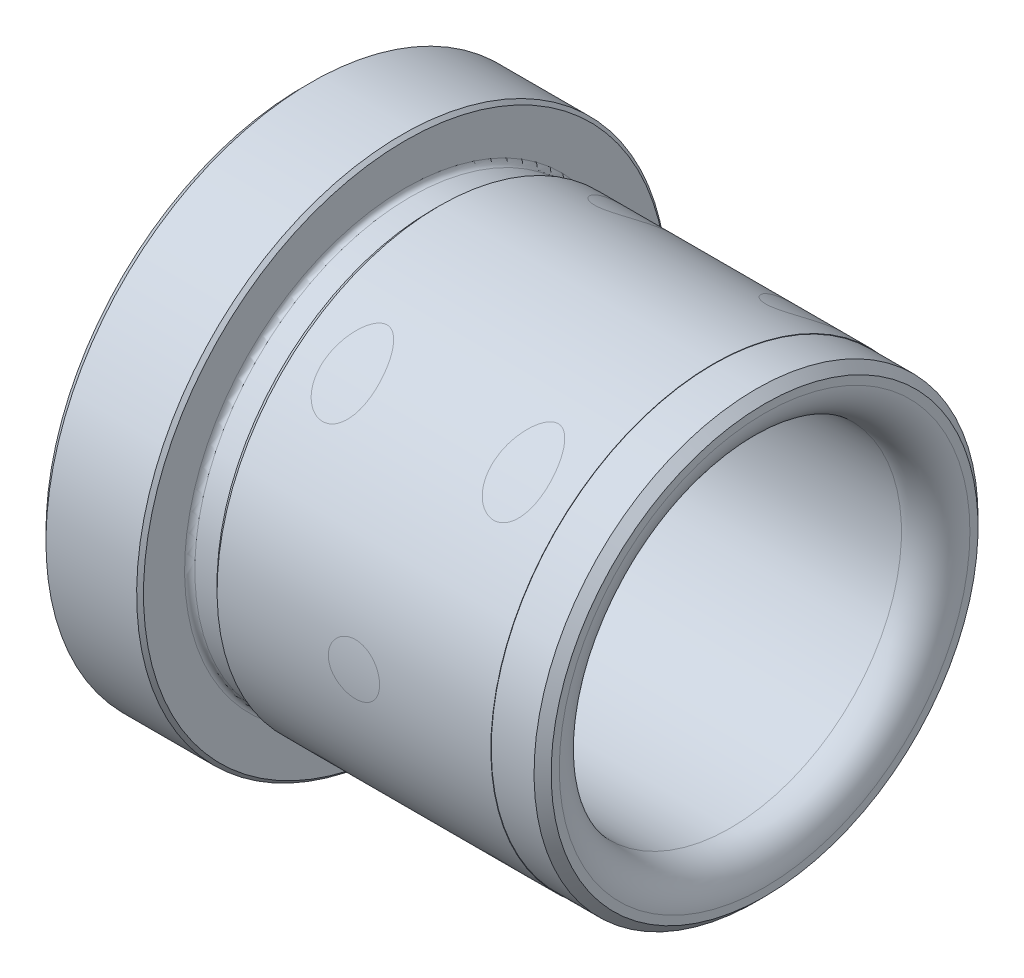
SolidWorks part; units mm, degrees
ref_plane "Front Plane" through (0, 0, 0) normal (0, 0, 1) x (1, 0, 0)
ref_plane "Top Plane" through (0, 0, 0) normal (0, 1, 0) x (1, 0, 0)
ref_plane "Right Plane" through (0, 0, 0) normal (1, 0, 0) x (0, 0, -1)
sketch "Sketch1" plane through (0, 0, 0) normal (0, 0, 1) x (1, 0, 0)
  line L0 (13.5, 12.975) -> (10.5, 12.975)
  line L1 (10.5, 13) -> (-5.5, 13)
  line L2 (10.5, 12.975) -> (10.5, 13)
  line L6 (-7.5, 15.5) -> (-7.5, 12.9)
  line L7 (-7.5, 15.5) -> (-13.5, 15.5)
  line L8 (-13.5, 15.5) -> (-13.5, 0)
  line L13 (13.5, 12.975) -> (13.5, 0)
  line L14 (13.5, 0) -> (-13.5, 0) construction
  line L15 (13.5, 0) -> (-13.5, 0)
  line L16 (-5.5, 13) -> (-5.9, 12.6)
  line L17 (-5.9, 12.6) -> (-7.2, 12.6)
  arc A0 (-7.2, 12.6) -> (-7.5, 12.9) centre (-7.2, 12.9) cw
  point P16 (0, 0)
  dimension "D5" = 0.025
  dimension "D1" = 0.3
  dimension "D2" = 135
  dimension "OD" = 26
  dimension "D3" = 0.4
  dimension "T" = 6
  dimension "HeadDia" = 31
  dimension "S" = 27
  dimension "HeadGap" = 2
  dimension "LeadLength" = 3
revolve "Revolve1" add sketch "Sketch1" angle 360 about L14
sketch "Sketch2" plane through (13.5, 0, 0) normal (1, 0, 0) x (0, 0, -1)
  circle A0 centre (0, 0) radius 10
  circle A1 centre (0, 0) radius 13 construction
  dimension "ID" = 20
extrude "Extrude1" cut sketch "Sketch2" against normal blind 56
sketch "Sketch4" [suppressed] plane through (-48, 0, 0) normal (1, 0, 0) x (0, 0, -1)
  circle A0 centre (0, 0) radius 21.01
  circle A2 centre (0, 0) radius 21 construction
  dimension "D1" = 0.01
extrude "Extrude3" [suppressed] cut sketch "Sketch4" against normal through all
fillet "Fillet2" radius 2 1 edges at (13.5, 10, 0)
chamfer "Chamfer5" distance 0.2 angle 45 1 edges at (-7.5, 15.5, 0)
chamfer "Chamfer3" distance 0.5 angle 45 1 edges at (13.5, 12.975, 0)
chamfer "Chamfer4" distance 0.5 angle 45 1 edges at (-13.5, 15.5, 0)
chamfer "Chamfer6" [suppressed] distance 0.5 angle 45
chamfer "Chamfer7" distance 0.5 angle 45 1 edges at (-13.5, -10, 0)
sketch "Sketch5" plane through (0, 0, 0) normal (0, 0, 1) x (1, 0, 0)
  line L0 (-5.5, 0) -> (10.5, 0) construction
  line L1 (-5.5, 13) -> (-5.5, -13) construction
  line L2 (10.5, -13) -> (10.5, 13) construction
  line L3 (2.5, 0) -> (2.5, 11.6457) construction
  circle A0 centre (2.5, 0) radius 1.5 construction
  circle A1 centre (-2.5, 10) radius 1.5
  circle A2 centre (7.5, 10) radius 1.5 construction
  circle A3 centre (-2.5, -10) radius 1.5 construction
  circle A4 centre (7.5, -10) radius 1.5 construction
  dimension "D1" = 3
  dimension "D2" = 5
  dimension "D3" = 10
sketch "Sketch6" plane through (0, 0, 0) normal (0, 0, 1) x (1, 0, 0)
  circle A0 centre (7.5, 10) radius 1.5 construction
  circle A1 centre (7.5, 10) radius 1.5
sketch "Sketch7" plane through (0, 0, 0) normal (0, 0, 1) x (1, 0, 0)
  circle A0 centre (-2.5, -10) radius 1.5 construction
  circle A1 centre (-2.5, -10) radius 1.5
sketch "Sketch8" plane through (0, 0, 0) normal (0, 0, 1) x (1, 0, 0)
  circle A0 centre (7.5, -10) radius 1.5 construction
  circle A1 centre (7.5, -10) radius 1.5
sketch "Sketch10" plane through (0, 0, 0) normal (0, 0, 1) x (1, 0, 0)
  circle A0 centre (2.5, 0) radius 1.5 construction
  circle A1 centre (2.5, 0) radius 1.5
